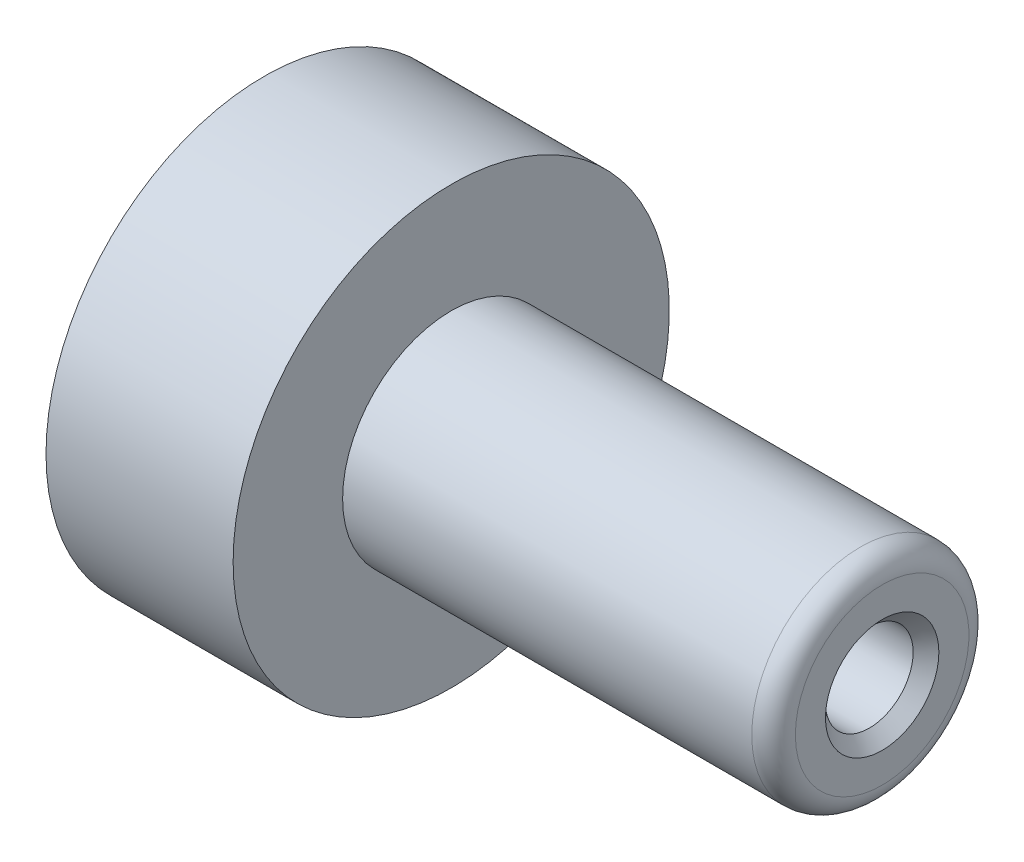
SolidWorks part; units mm, degrees
ref_plane "Front Plane" through (0, 0, 0) normal (0, 0, 1) x (1, 0, 0)
ref_plane "Top Plane" through (0, 0, 0) normal (0, 1, 0) x (1, 0, 0)
ref_plane "Right Plane" through (0, 0, 0) normal (1, 0, 0) x (0, 0, -1)
sketch "Sketch1" plane through (0, 0, 0) normal (0, 0, 1) x (1, 0, 0)
  line L0 (0, 0) -> (102.3864, 0) construction
  line L1 (0, 3.9751) -> (0, 12.7)
  line L2 (0, 12.7) -> (10.8966, 12.7)
  line L3 (10.8966, 12.7) -> (10.8966, 6.3246)
  line L4 (10.8966, 6.3246) -> (34.7218, 6.3246)
  line L5 (35.9918, 5.0546) -> (35.9918, 0)
  line L6 (35.9918, 0) -> (21.8948, 0)
  line L7 (0, 3.9751) -> (21.8948, 3.9751)
  line L8 (21.8948, 3.9751) -> (21.8948, 0)
  arc A0 (35.9918, 5.0546) -> (34.7218, 6.3246) centre (34.7218, 5.0546) ccw
  dimension "D5" = 1.27
  dimension "D1" = 10.8966
  dimension "D2" = 25.4
  dimension "D3" = 21.8948
  dimension "D4" = 7.9502
  dimension "D6" = 35.9918
  dimension "D7" = 12.6492
revolve "Revolve1" add sketch "Sketch1" angle 360 about L0
sketch "Sketch2" plane through (0, 0, 0) normal (-1, 0, 0) x (0, 0, 1)
  line L0 (0, 0) -> (0, 9.7644) construction
  circle A0 centre (-7.1374, 0) radius 1.6129
  circle A1 centre (7.1374, 0) radius 1.6129
  dimension "D2" = 3.2258
  dimension "D1" = 14.2748
extrude "Cut-Extrude1" cut sketch "Sketch2" against normal blind 6.35
sketch "Sketch3" plane through (35.9918, 0, 0) normal (1, 0, 0) x (0, 0, -1)
  circle A0 centre (0, 0) radius 2.5527
  dimension "D1" = 5.1054
extrude "Cut-Extrude2" cut sketch "Sketch3" against normal through all
chamfer "Chamfer1" distance 0.7493 angle 45 1 edges at (35.9918, 0, -2.5527)
